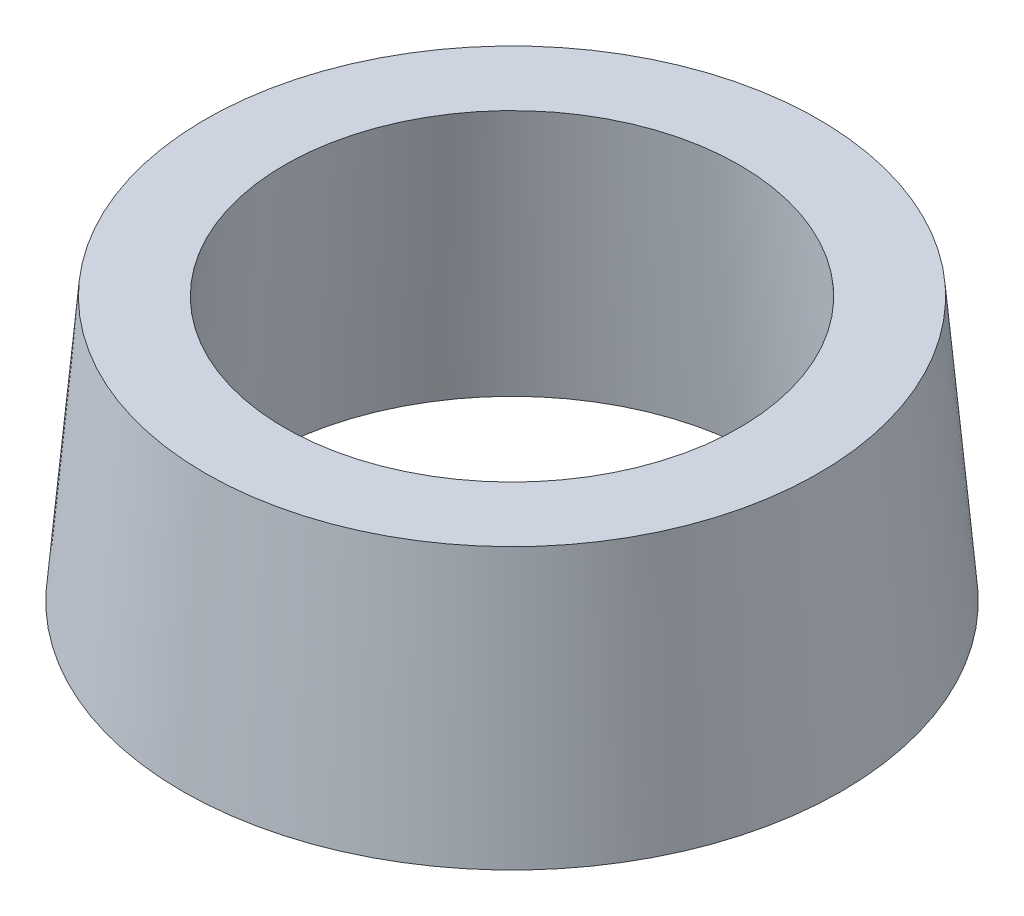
SolidWorks part; units mm, degrees
ref_plane "Plan de face" through (0, 0, 0) normal (0, 0, 1) x (1, 0, 0)
ref_plane "Plan de dessus" through (0, 0, 0) normal (0, 1, 0) x (1, 0, 0)
ref_plane "Plan de droite" through (0, 0, 0) normal (1, 0, 0) x (0, 0, -1)
sketch "Esquisse2" plane through (0, 0, 0) normal (0, 1, 0) x (1, 0, 0)
  circle A0 centre (0, 0) radius 6.25
  dimension "D1" = 12.5
extrude "Boss.-Extru.1" add sketch "Esquisse2" along normal blind 5 draft 5
sketch "Esquisse3" plane through (0, 0, 0) normal (0, -1, 0) x (1, 0, 0)
  circle A0 centre (0, 0) radius 4.75
  dimension "D1" = 9.5
extrude "Enlèv. mat.-Extru.1" cut sketch "Esquisse3" against normal blind 5 draft 5
